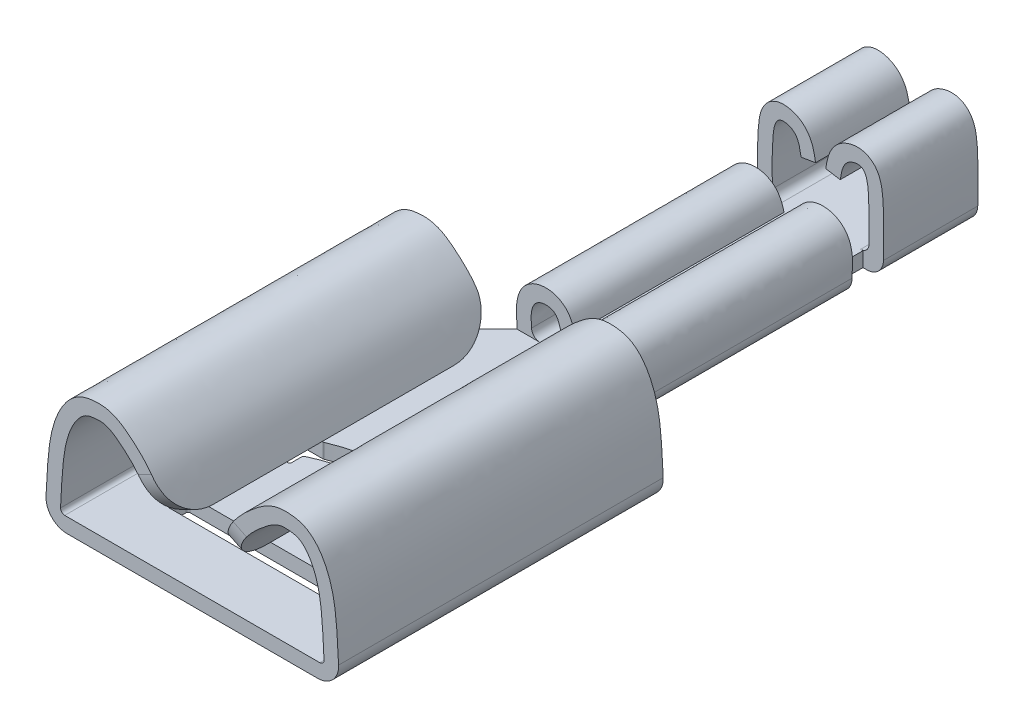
SolidWorks part; units mm, degrees
ref_plane "Plan de face" through (0, 0, 0) normal (0, 0, 1) x (1, 0, 0)
ref_plane "Plan de dessus" through (0, 0, 0) normal (0, 1, 0) x (1, 0, 0)
ref_plane "Plan de droite" through (0, 0, 0) normal (1, 0, 0) x (0, 0, -1)
sketch "Esquisse1" plane through (0, 0, 0) normal (0, 0, 1) x (1, 0, 0)
  line L0 (0.8144, 1.1962) -> (0.5, 1.35)
  line L1 (3.1503, 0.3344) -> (3.5, 0.35)
  line L2 (2.1646, 3.0977) -> (2.7697, 3.0022) construction
  spline S0 degree 3 poles (3.5, 0.35) (3.486, 0.6654) (3.4561, 1.3361) (3.3247, 2.3376) (2.8454, 2.9903) (2.089, 3.1096) (1.8477, 3.0565) (1.1134, 2.448) (0.8722, 2.1106) (0.6098, 1.5744) (0.5, 1.35) knots 0 0 0 0 0.162898 0.346347 0.525763 0.525763 0.704901 0.704901 0.876545 1 1 1 1
  spline S1 degree 1 poles (3.1503, 0.3344) (0.8144, 1.1962) knots 0 0 1 1 construction
  spline S2 degree 3 poles (3.1503, 0.3344) (3.1397, 0.5735) (3.1168, 1.0569) (3.0682, 1.6327) (2.9702, 2.0399) (2.8489, 2.3365) (2.6782, 2.5766) (2.5334, 2.678) (2.3922, 2.7103) (2.1796, 2.7292) (2.0475, 2.7052) (1.856, 2.6092) (1.6125, 2.408) (1.4232, 2.2331) (1.2745, 2.0586) (1.0944, 1.7665) (0.9176, 1.4072) (0.8144, 1.1962) knots 0 0 0 0 0.125 0.25 0.3125 0.375 0.4375 0.5 0.53125 0.5625 0.625 0.6875 0.71875 0.75 0.8125 0.875 1 1 1 1
  dimension "D6" = 0.35
extrude "Extrusion1" add sketch "Esquisse1" along normal blind 7.75
sketch "Esquisse2" plane through (0, 0, 7.75) normal (0, 0, 1) x (1, 0, 0)
  line L0 (3.5, 0.35) -> (3.1525, 0.3348)
  line L1 (0, 0) -> (3.5, 0)
  line L2 (3.5, 0) -> (3.5, 0.35)
  line L3 (0, 0) -> (0, 0.35)
  line L4 (0, 0.35) -> (3.1525, 0.35)
  line L5 (3.1525, 0.35) -> (3.1525, 0.3348)
  dimension "D1" = 0.35
extrude "Extrusion2" add sketch "Esquisse2" against normal blind 7.75
fillet "Congé1" radius 1 2 edges at (0.6572, 1.2731, 7.75) (0.6572, 1.2731, 0)
mirror "Symétrie6" about plane through (0, 0, 0) normal (1, 0, 0) of "Extrusion2", "Extrusion1"
mirror "Symétrie7" about plane through (0, 0, 0) normal (1, 0, 0) of "Congé1", "Extrusion1"
ref_plane "Plan1" through (-1, 0, 0) normal (-1, 0, 0) x (0, 0, 1)
sketch "Esquisse6" plane through (0, 0, 0) normal (0, -1, 0) x (1, 0, 0)
  line L0 (2, 3.2) -> (2, 3.95)
  line L1 (1.95, 6.3491) -> (-1.95, 6.3491)
  line L2 (2, 6.2991) -> (2, 5.8991)
  line L3 (1.95, 5.8491) -> (-1.95, 5.8491)
  line L4 (-2, 6.2991) -> (-2, 5.8991)
  line L5 (1.95, 3.15) -> (1.4821, 3.15)
  line L6 (1.95, 4) -> (1.4779, 4)
  line L7 (1.4279, 3.95) -> (1.4279, 3.7109)
  line L8 (0, 3.3491) -> (0, 2.5328) construction
  line L9 (-1.4279, 3.95) -> (-1.4279, 3.7109)
  line L10 (-1.95, 4) -> (-1.4779, 4)
  line L11 (-1.95, 3.15) -> (-1.4821, 3.15)
  line L12 (-2, 3.2) -> (-2, 3.95)
  arc A0 (1.95, 6.3491) -> (2, 6.2991) centre (1.95, 6.2991) cw
  arc A1 (2, 5.8991) -> (1.95, 5.8491) centre (1.95, 5.8991) cw
  arc A2 (-1.95, 6.3491) -> (-2, 6.2991) centre (-1.95, 6.2991) ccw
  arc A3 (-1.95, 5.8491) -> (-2, 5.8991) centre (-1.95, 5.8991) cw
  arc A4 (-1.3994, 3.6658) -> (1.3994, 3.6658) centre (0, 6.5991) ccw
  arc A5 (-1.4626, 3.146) -> (1.4626, 3.146) centre (0, 6.5991) ccw
  arc A6 (2, 3.2) -> (1.95, 3.15) centre (1.95, 3.2) cw
  arc A7 (2, 3.95) -> (1.95, 4) centre (1.95, 3.95) ccw
  arc A8 (1.4779, 4) -> (1.4279, 3.95) centre (1.4779, 3.95) ccw
  arc A9 (1.4279, 3.7109) -> (1.3994, 3.6658) centre (1.3779, 3.7109) cw
  arc A10 (1.4626, 3.146) -> (1.4821, 3.15) centre (1.4821, 3.1) cw
  arc A11 (-1.4279, 3.7109) -> (-1.3994, 3.6658) centre (-1.3779, 3.7109) ccw
  arc A12 (-1.4279, 3.95) -> (-1.4779, 4) centre (-1.4779, 3.95) ccw
  arc A13 (-1.95, 4) -> (-2, 3.95) centre (-1.95, 3.95) ccw
  arc A14 (-1.95, 3.15) -> (-2, 3.2) centre (-1.95, 3.2) cw
  arc A15 (-1.4821, 3.15) -> (-1.4626, 3.146) centre (-1.4821, 3.1) cw
  point P7 (2, 6.3491)
  point P10 (2, 5.8491)
  point P13 (-2, 6.3491)
  point P18 (0, 3.3491)
  point P20 (0, 2.8491)
  point P33 (2, 3.15)
  point P36 (2, 4)
  point P39 (1.4279, 4)
  point P42 (1.4279, 3.6795)
  point P45 (1.4719, 3.15)
  point P48 (-1.4279, 3.6795)
  point P51 (-1.4279, 4)
  point P54 (-2, 4)
  point P57 (-2, 3.15)
  point P60 (-1.4719, 3.15)
  dimension "D4" = 0.05
  dimension "D8" = 0.05
  dimension "D9" = 3.25
  dimension "D1" = 0.5
  dimension "D2" = 2
  dimension "D3" = 4
  dimension "D5" = 3
  dimension "D6" = 0.5
  dimension "D7" = 2
  dimension "D10" = 1.4279
  dimension "D11" = 4
  dimension "D12" = 0.85
extrude "Enlèv. mat.-Extru.2" cut sketch "Esquisse6" against normal blind 1
fillet "Congé17" radius 0.5 2 edges at (3.5, 0, 3.875) (-3.5, 0, 3.875)
fillet "Congé19" radius 0.1 2 edges at (-3.1497, 0.35, 3.875) (3.1497, 0.35, 3.875)
sketch "Esquisse8" plane through (0, 0, 0) normal (0, 0, -1) x (-1, 0, 0)
  line L0 (-3.045, 0.35) -> (3.045, 0.35) construction
  line L1 (-1.5, 0.35) -> (1.5, 0.35)
  line L2 (-1.5, 0.35) -> (-1.5, 0)
  line L3 (-1.5, 0) -> (1.5, 0)
  line L4 (1.5, 0.35) -> (1.5, 0)
  line L5 (2.9928, 0) -> (-2.9928, 0) construction
  dimension "D1" = 1.5
  dimension "D2" = 1.5
extrude "Extrusion3" add sketch "Esquisse8" along normal blind 9.5
chamfer "Chanfrein1" distance 1.5 angle 45 4 edges at (-2.2464, 0, 0) (2.2464, 0, 0) (1.5, 0.175, 0) (-1.5, 0.175, 0)
sketch "Esquisse9" plane through (0, 0, -9.5) normal (0, 0, -1) x (-1, 0, 0)
  line L0 (1.5, 0.35) -> (-1.5, 0.35) construction
  line L1 (0.1214, 1.6026) -> (0.4667, 1.5455)
  line L2 (1.15, 0.35) -> (1.5, 0.3441)
  spline S0 degree 3 poles (1.15, 0.35) (1.1536, 0.5657) (1.1607, 0.9873) (1.1558, 1.5106) (1.0889, 2.1414) (0.5451, 2.02) (0.4972, 1.7303) (0.4667, 1.5455) knots 0 0 0 0 0.248709 0.486196 0.685851 0.799598 1 1 1 1
  spline S1 degree 1 poles (1.5, 0.3441) (0.1214, 1.6026) knots 0 0 1 1 construction
  spline S2 degree 3 poles (1.5, 0.3441) (1.5018, 0.4523) (1.5054, 0.6706) (1.509, 0.9865) (1.5073, 1.2962) (1.496, 1.5757) (1.4657, 1.8762) (1.4064, 2.0963) (1.2662, 2.2935) (1.0697, 2.4126) (0.8728, 2.434) (0.6596, 2.4036) (0.4059, 2.282) (0.2192, 2.0232) (0.152, 1.787) (0.1321, 1.6675) (0.1214, 1.6026) knots 0 0 0 0 0.125 0.25 0.375 0.5 0.5625 0.625 0.65625 0.6875 0.71875 0.75 0.8125 0.875 0.9375 1 1 1 1
extrude "Extrusion4" add sketch "Esquisse9" against normal blind 2.25
mirror "Symétrie10" about plane through (0, 0, 0) normal (1, 0, 0) of "Extrusion4"
ref_plane "Plan2" through (0, 0, -6.5) normal (0, 0, -1) x (-1, 0, 0)
sketch "Esquisse10" plane through (0, 0, -6.5) normal (0, 0, -1) x (-1, 0, 0)
  line L0 (1.15, 0.35) -> (1.5, 0.35)
  line L1 (0.1217, 0.9519) -> (0.4578, 0.8542)
  spline S0 degree 3 poles (1.15, 0.35) (1.15, 0.4346) (1.15, 0.599) (1.175, 0.8597) (1.0823, 1.1379) (0.8178, 1.2192) (0.5429, 1.1468) (0.4889, 0.9611) (0.4578, 0.8542) knots 0 0 0 0 0.161508 0.314117 0.508183 0.657329 0.802607 1 1 1 1
  spline S1 degree 3 poles (0.4667, 1.5455) (0.4972, 1.7303) (0.5451, 2.02) (1.0889, 2.1414) (1.1558, 1.5106) (1.1607, 0.9873) (1.1536, 0.5657) (1.15, 0.35) knots 0 0 0 0 0.200402 0.314149 0.513804 0.751291 1 1 1 1 construction
  spline S2 degree 3 poles (1.2947, 2.0744) (1.2903, 2.0686) (1.2332, 1.9915) (1.0944, 1.7665) (0.9176, 1.4072) (0.8144, 1.1962) knots 0.807408 0.807408 0.807408 0.807408 0.8125 0.875 1 1 1 1 construction
  spline S3 degree 1 poles (1.5, 0.35) (0.1217, 0.9519) knots 0 0 1 1 construction
  spline S4 degree 3 poles (1.5, 0.35) (1.5, 0.4119) (1.4985, 0.5391) (1.5158, 0.7097) (1.5021, 1.0235) (1.3634, 1.3267) (1.1061, 1.4979) (0.8529, 1.5605) (0.6068, 1.5478) (0.3353, 1.3874) (0.2115, 1.2114) (0.1538, 1.0624) (0.1332, 0.9913) (0.1217, 0.9519) knots 0 0 0 0 0.125 0.25 0.375 0.5 0.5625 0.625 0.75 0.8125 0.875 0.9375 1 1 1 1
extrude "Extrusion5" add sketch "Esquisse10" against normal up to vertex
mirror "Symétrie12" about plane through (0, 0, 0) normal (1, 0, 0) of "Extrusion5"
fillet "Congé26" radius 0.2 4 edges at (-1.15, 0.35, -8.375) (-1.15, 0.35, -4) (1.15, 0.35, -8.375) (1.15, 0.35, -4)
sketch "Esquisse11" plane through (0, 0.35, 0) normal (0, 1, 0) x (-1, 0, 0)
  line L0 (-1.5107, -6.5) -> (-0.1217, -6.5) construction
  line L1 (-1.8234, -7.25) -> (-1.0107, -7.25)
  line L2 (-1.8234, -7.25) -> (-1.8234, -6.5)
  line L3 (-1.8234, -6.5) -> (-1.0107, -6.5)
  line L4 (-1.0107, -7.25) -> (-1.0107, -6.5)
  line L5 (1.5082, -7.25) -> (0.1214, -7.25) construction
  line L6 (1.82, -6.5) -> (1.0107, -6.5)
  line L7 (1.82, -6.5) -> (1.82, -7.25)
  line L8 (1.82, -7.25) -> (1.0107, -7.25)
  line L9 (1.0107, -6.5) -> (1.0107, -7.25)
  line L10 (-1.5107, -1.5) -> (-1.5107, -6.5) construction
  line L11 (1.5107, -6.5) -> (1.5107, -1.5) construction
  dimension "D1" = 0.5
  dimension "D2" = 0.5
extrude "Enlèv. mat.-Extru.4" cut sketch "Esquisse11" against normal blind 2.25
fillet "Congé29" radius 0.4 4 edges at (1.5, 0, -8.375) (1.5, 0, -4) (-1.5, 0, -4) (-1.5, 0, -8.375)
